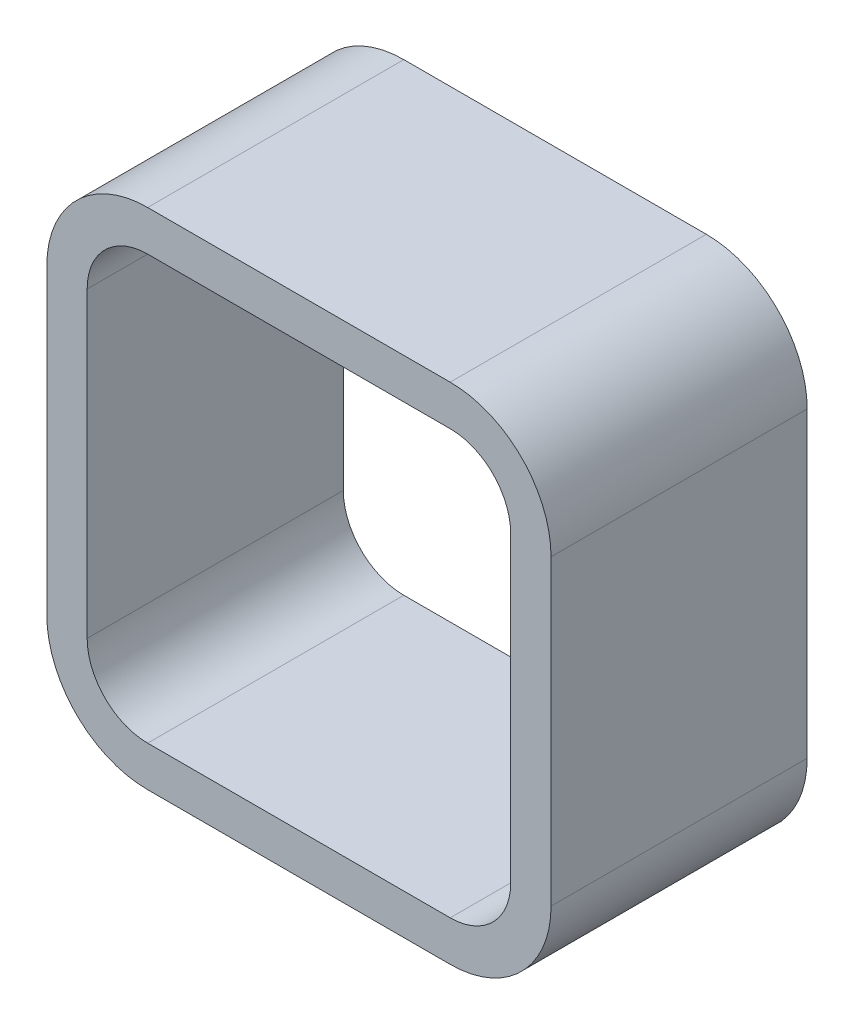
SolidWorks part; units mm, degrees
ref_plane "Front Plane" through (0, 0, 0) normal (0, 0, 1) x (1, 0, 0)
ref_plane "Top Plane" through (0, 0, 0) normal (0, 1, 0) x (1, 0, 0)
ref_plane "Right Plane" through (0, 0, 0) normal (1, 0, 0) x (0, 0, -1)
sketch "Sketch1" plane through (0, 0, 0) normal (0, 0, 1) x (1, 0, 0)
  line L0 (-15, 21) -> (15, 21)
  line L1 (-15, -25) -> (15, -25)
  line L2 (-25, -15) -> (-25, 15)
  line L3 (-15, 25) -> (15, 25)
  line L4 (25, -15) -> (25, 15)
  line L5 (-25, -25) -> (25, 25) construction
  line L6 (-25, 25) -> (25, -25) construction
  line L7 (21, -15) -> (21, 15)
  line L8 (-15, -21) -> (15, -21)
  line L9 (-21, -15) -> (-21, 15)
  arc A0 (-25, 15) -> (-15, 25) centre (-15, 15) cw
  arc A1 (15, 25) -> (25, 15) centre (15, 15) cw
  arc A2 (-15, -25) -> (-25, -15) centre (-15, -15) cw
  arc A3 (15, -25) -> (25, -15) centre (15, -15) ccw
  arc A4 (-21, 15) -> (-15, 21) centre (-15, 15) cw
  arc A5 (15, 21) -> (21, 15) centre (15, 15) cw
  arc A6 (15, -21) -> (21, -15) centre (15, -15) ccw
  arc A7 (-15, -21) -> (-21, -15) centre (-15, -15) cw
  point P0 (0, 0)
  dimension "D2" = 10
  dimension "Thickness" = 4
  dimension "Width" = 50
extrude "BaseSection" add sketch "Sketch1" along normal mid plane 25.4
equation "\"D2@Sketch1\" = \"Thickness@Sketch1\" * (  (IIf(\"Thickness@Sketch1\">3, 1.5, 1))  + 1 ) "
